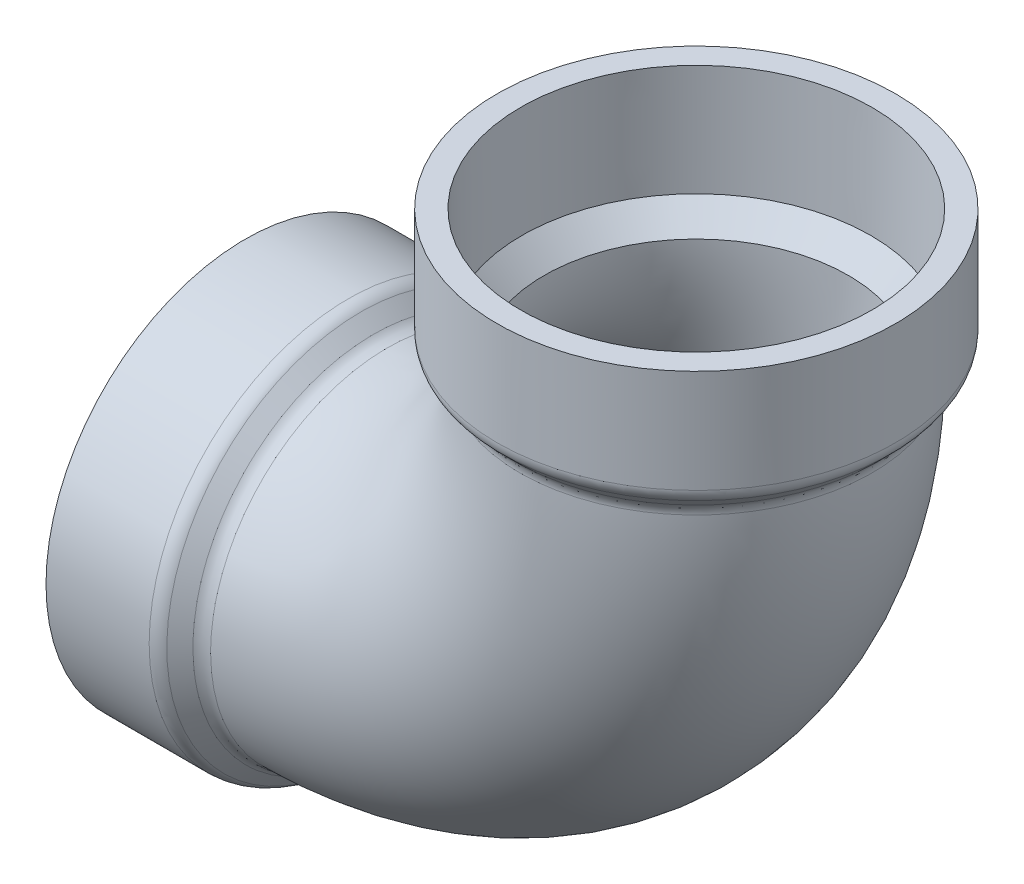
SolidWorks part; units mm, degrees
ref_plane "Front Plane" through (0, 0, 0) normal (0, 0, 1) x (1, 0, 0)
ref_plane "Top Plane" through (0, 0, 0) normal (0, 1, 0) x (1, 0, 0)
ref_plane "Right Plane" through (0, 0, 0) normal (1, 0, 0) x (0, 0, -1)
sketch "Sketch0" plane through (0, 0, 0) normal (0, 0, 1) x (1, 0, 0)
  line L0 (-77.7875, 0) -> (0, 0) construction
  line L1 (0, 0) -> (0, 77.7875) construction
  line L2 (-58.7375, 0) -> (0, 0) construction
  line L3 (0, 0) -> (0, 58.7375) construction
  line L4 (-77.7875, 34.3535) -> (-77.7875, -34.3535) construction
  line L5 (-58.7375, 30.099) -> (-77.7875, 30.2895) construction
  line L6 (-58.7375, 30.099) -> (-58.7375, -30.099) construction
  line L7 (-58.7375, -30.099) -> (-77.7875, -30.2895) construction
  line L8 (-77.7875, 30.2895) -> (-77.7875, -30.2895) construction
  line L9 (-34.3535, 77.7875) -> (34.3535, 77.7875) construction
  line L10 (-30.2895, 77.7875) -> (30.2895, 77.7875) construction
  line L11 (30.2895, 77.7875) -> (30.099, 58.7375) construction
  line L12 (30.099, 58.7375) -> (-30.099, 58.7375) construction
  line L13 (-30.099, 58.7375) -> (-30.2895, 77.7875) construction
  line L14 (-58.7375, 26.2509) -> (-58.7375, -26.2509) construction
  line L15 (-58.7375, -26.2509) -> (-58.7375, -30.3149) construction
  line L16 (-77.7875, -30.2895) -> (-77.7875, -34.3535) construction
  line L17 (26.2509, 58.7375) -> (30.3149, 58.7375) construction
  line L18 (-26.2509, 58.7375) -> (26.2509, 58.7375) construction
  line L19 (30.2895, 77.7875) -> (34.3535, 77.7875) construction
  line L20 (0, 77.7875) -> (0, 58.7375) construction
  line L21 (-77.7875, 0) -> (-58.7375, 0) construction
  dimension "A" = 58.7375
  dimension "OD A" = 60.579
  dimension "OD B" = 60.198
  dimension "ID" = 52.5018
  dimension "H" = 4.064
  dimension "C" = 19.05
sketch "Sketch1" plane through (0, 0, 0) normal (0, 0, 1) x (1, 0, 0)
  line L0 (-77.7875, 0) -> (0, 0) construction
  line L1 (-77.7875, 0) -> (0, 0) construction
  line L2 (-58.7375, -34.3535) -> (-54.6989, -30.3149)
  line L3 (-77.7875, -34.3535) -> (-58.7375, -34.3535)
  line L4 (-77.7875, -34.3535) -> (-77.7875, -30.2895)
  line L5 (-77.7875, -30.2895) -> (-58.7375, -30.099)
  line L6 (-58.7375, -34.3535) -> (-58.7375, -30.099) construction
  line L7 (-54.6989, -30.3149) -> (-54.6989, -26.2509)
  line L8 (-54.6989, -26.2509) -> (-58.7375, -30.099)
  line L9 (-58.7375, -34.3535) -> (-54.6989, -34.3535) construction
  line L10 (-58.7375, -26.2509) -> (-54.6989, -26.2509) construction
  line L11 (-54.6989, -34.3535) -> (-54.6989, -30.3149) construction
  line L12 (-58.7375, -30.3149) -> (-54.6989, -30.3149) construction
revolve "Revolve1" add sketch "Sketch1" angle 360 about L1
sketch "Sketch2" plane through (0, 0, 0) normal (0, 0, 1) x (1, 0, 0)
  line L0 (30.2895, 77.7875) -> (30.099, 58.7375)
  line L1 (30.099, 58.7375) -> (34.3535, 58.7375) construction
  line L2 (34.3535, 58.7375) -> (34.3535, 77.7875)
  line L3 (34.3535, 77.7875) -> (30.2895, 77.7875)
  line L4 (0, 0) -> (0, 77.7875) construction
  line L5 (0, 0) -> (0, 77.7875) construction
  line L6 (30.099, 58.7375) -> (26.2509, 54.6989)
  line L7 (26.2509, 58.7375) -> (26.2509, 54.6989) construction
  line L8 (34.3535, 58.7375) -> (30.3149, 54.6989)
  line L9 (30.3149, 54.6989) -> (26.2509, 54.6989)
  line L10 (34.3535, 58.7375) -> (34.3535, 54.6989) construction
  line L11 (34.3535, 54.6989) -> (30.3149, 54.6989) construction
  line L12 (30.3149, 58.7375) -> (30.3149, 54.6989) construction
revolve "Revolve2" add sketch "Sketch2" angle 360 about L5
sketch "Sketch3" plane through (-54.6989, 0, 0) normal (1, 0, 0) x (0, 0, -1)
  circle A0 centre (0, 0) radius 26.2509
  circle A1 centre (0, 0) radius 30.3149
sketch "Sketch4" plane through (0, 0, 0) normal (0, 0, 1) x (1, 0, 0)
  line L0 (-77.7875, 0) -> (0, 0) construction
  line L1 (0, 0) -> (0, 77.7875) construction
  line L2 (-77.7875, 0) -> (-54.6989, 0) construction
  line L3 (0, 54.6989) -> (0, 77.7875) construction
  line L4 (-54.6989, -30.3149) -> (-54.6989, 30.3149) construction
  arc A0 (-54.6989, 0) -> (0, 54.6989) centre (-54.6989, 54.6989) ccw
sweep "Sweep1" add profiles "Sketch3" path "Sketch4"
fillet "Fillet1" radius 3.048 4 edges at (-54.6989, 0, -30.3149) (0, 54.6989, -30.3149) (0, 58.7375, -34.3535) (-58.7375, 0, 34.3535)
equation "\"D1@Fillet1\" = \"H@Sketch0\" * 3 / 4"
